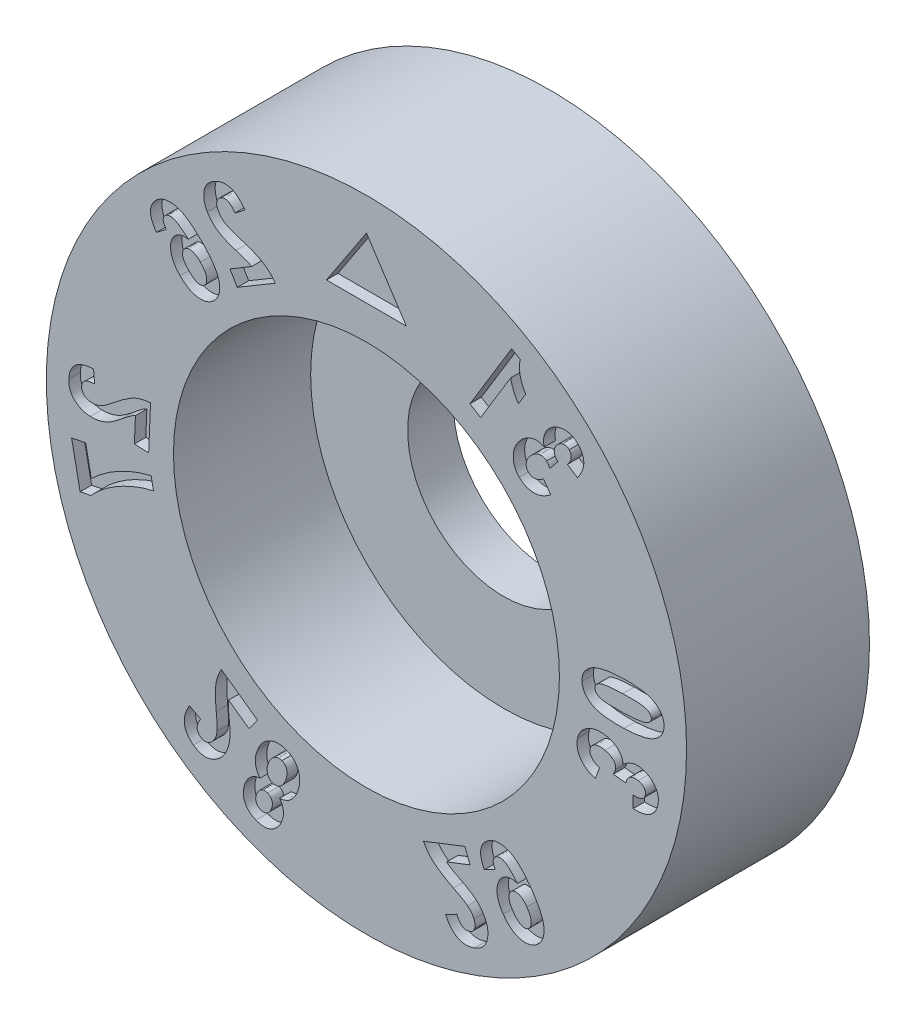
SolidWorks part; units mm, degrees
ref_plane "Front Plane" through (0, 0, 0) normal (0, 0, 1) x (1, 0, 0)
ref_plane "Top Plane" through (0, 0, 0) normal (0, 1, 0) x (1, 0, 0)
ref_plane "Right Plane" through (0, 0, 0) normal (1, 0, 0) x (0, 0, -1)
sketch "Sketch4" plane through (0, 0, 0) normal (0, 0, 1) x (1, 0, 0)
  circle A0 centre (0, 0) radius 7
  dimension "D1" = 14
extrude "Boss-Extrude2" add sketch "Sketch4" against normal blind 4
sketch "Sketch5" plane through (0, 0, 0) normal (0, 0, 1) x (1, 0, 0)
  circle A0 centre (0, 0) radius 4.22
  dimension "D1" = 8.44
extrude "Cut-Extrude2" cut sketch "Sketch5" against normal blind 3
sketch "Sketch6" plane through (0, 0, -3) normal (0, 0, 1) x (1, 0, 0)
  circle A0 centre (0, 0) radius 2.1
  dimension "D1" = 4.2
extrude "Cut-Extrude3" cut sketch "Sketch6" against normal through all
sketch "Sketch1" plane through (0, 0, 0) normal (0, 0, 1) x (1, 0, 0)
  line L6 (0.8741, 4.9578) -> (0, 6.2846)
  line L7 (0, 6.2846) -> (-0.8741, 4.9578)
  line L8 (-0.8741, 4.9578) -> (0.8741, 4.9578)
sketch "Sketch2" plane through (0, 0, 0) normal (0, 0, 1) x (1, 0, 0)
  arc A0 (-1.9477, 4.3647) -> (1.8991, 4.386) centre (0, 0) ccw construction
  text T4 "26    27    28    29    30    31" font "Arial Narrow" height 1.75
extrude "Cut-Extrude1" cut sketch "Sketch2" against normal blind 0.25
extrude "Cut-Extrude4" cut sketch "Sketch1" against normal blind 0.25
sketch "Sketch7" plane through (0, 0, 0) normal (0, 1, 0) x (1, 0, 0)
  line L0 (7, 4) -> (-7, 4) construction
  line L1 (-4.5, 4) -> (-5.5, 4)
  arc A0 (-5.5, 4) -> (-4.5, 4) centre (-5, 4) cw
  dimension "D2" = 0.5
  dimension "D1" = 5
revolve "Revolve1" add sketch "Sketch7" angle 360 about L1
